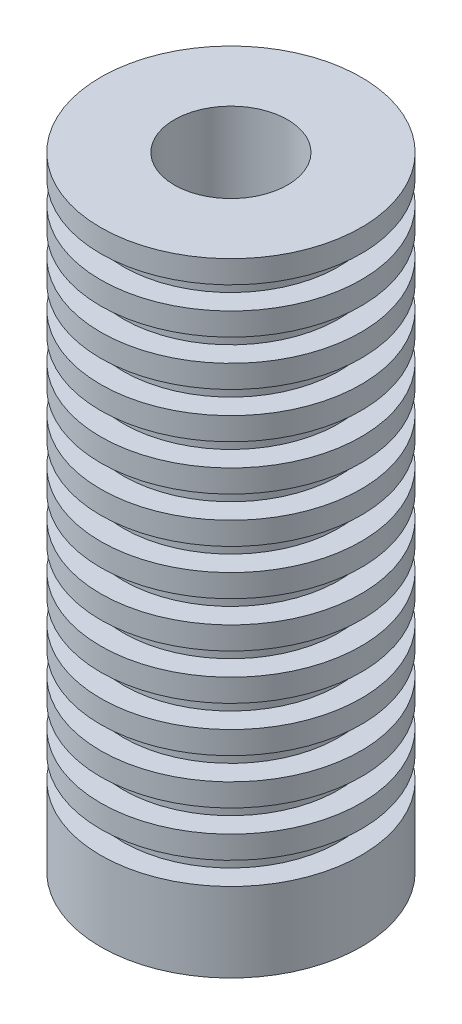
SolidWorks part; units mm, degrees
ref_plane "Front Plane" through (0, 0, 0) normal (0, 0, 1) x (1, 0, 0)
ref_plane "Top Plane" through (0, 0, 0) normal (0, 1, 0) x (1, 0, 0)
ref_plane "Right Plane" through (0, 0, 0) normal (1, 0, 0) x (0, 0, -1)
sketch "Sketch1" plane through (0, 0, 0) normal (0, 1, 0) x (1, 0, 0)
  circle A0 centre (0, 0) radius 5.75
  dimension "D1" = 11.5
extrude "power cylinder OD" add sketch "Sketch1" along normal mid plane 27.5
sketch "Sketch2" plane through (0, 0, 0) normal (0, 1, 0) x (1, 0, 0)
  circle A0 centre (0, 0) radius 2.5
  dimension "D1" = 5
extrude "power cylider bore" cut sketch "Sketch2" against normal through all both and the other way through all
sketch "Sketch4" plane through (0, 0, 0) normal (0, 0, 1) x (1, 0, 0)
  line L0 (5.75, -13.75) -> (5.75, 13.75) construction
  line L1 (5.75, -9.25) -> (4.75, -9.25)
  line L2 (5.75, -9.25) -> (5.75, -10.25)
  line L3 (5.75, -10.25) -> (4.75, -10.25)
  line L4 (4.75, -9.25) -> (4.75, -10.25)
  line L6 (-5.75, -13.75) -> (5.75, -13.75) construction
  dimension "D1" = 1
  dimension "D2" = 3.5
  dimension "D3" = 4.75
revolve "Cut-Revolve1" cut sketch "Sketch4" angle 360 about axis through (0, 13.75, 0) along (0, -1, 0)
pattern_linear "LPattern1" count 12 spacing 2 along (0, 1, 0) of "Cut-Revolve1"
